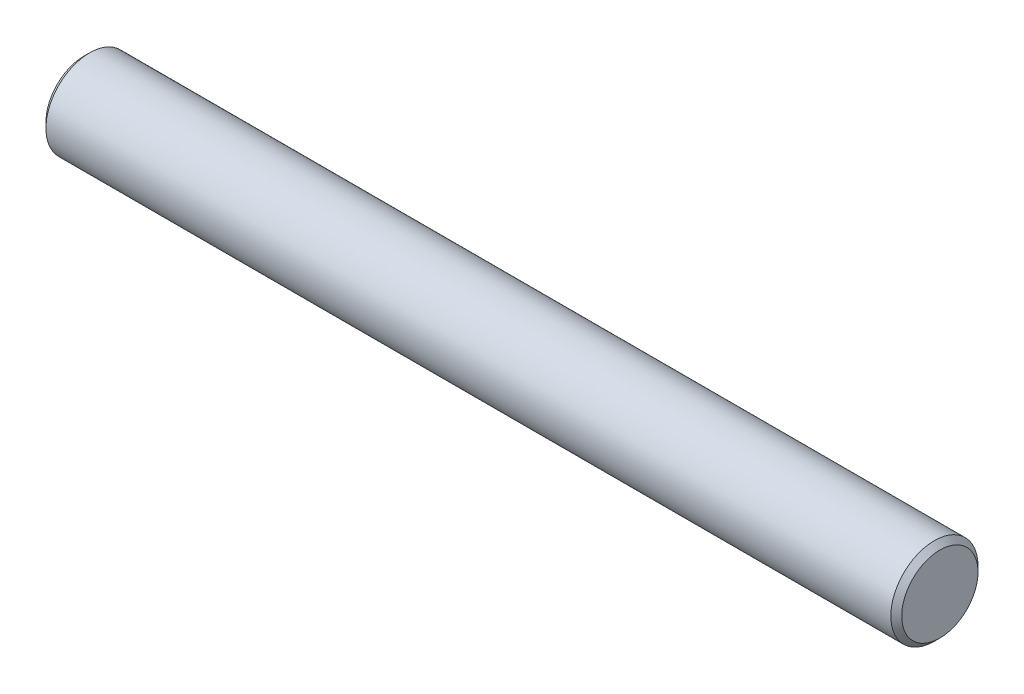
SolidWorks part; units mm, degrees
ref_plane "Front" through (0, 0, 0) normal (0, 0, 1) x (1, 0, 0)
ref_plane "Top" through (0, 0, 0) normal (0, 1, 0) x (1, 0, 0)
ref_plane "Right" through (0, 0, 0) normal (1, 0, 0) x (0, 0, -1)
sketch "Sketch1" plane through (0, 0, 0) normal (1, 0, 0) x (0, 0, -1)
  circle A0 centre (0, 0) radius 8
  dimension "D1" = 16
extrude "Extrude1" add sketch "Sketch1" along normal blind 157
chamfer "Chamfer1" distance 1 angle 45 2 edges at (0, 0, -8) (157, 0, -8)
